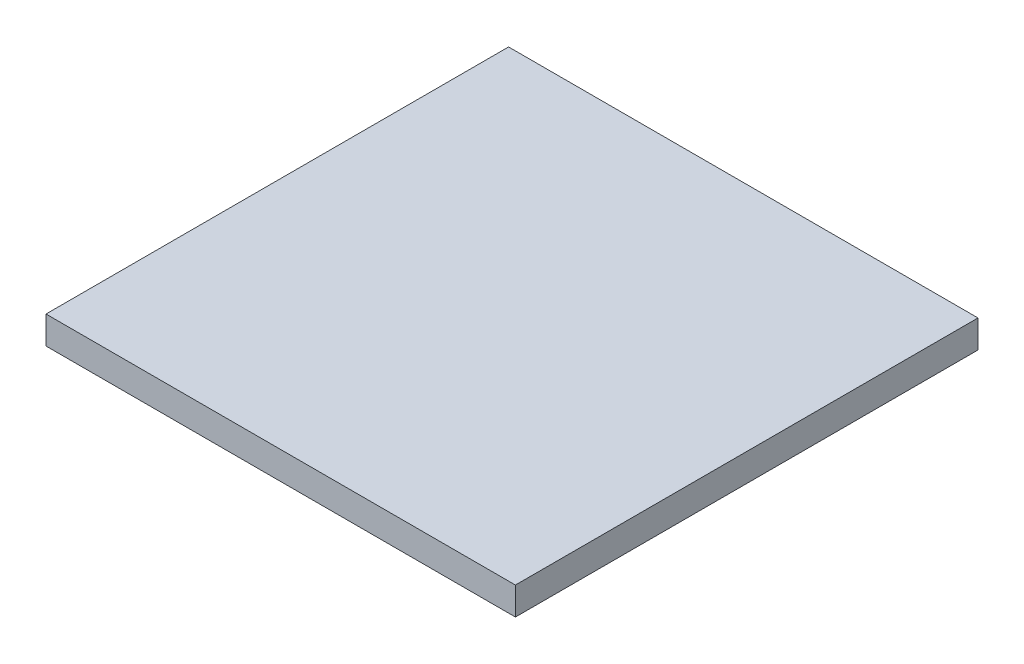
SolidWorks part; units mm, degrees
ref_plane "Front" through (0, 0, 0) normal (0, 0, 1) x (1, 0, 0)
ref_plane "Top" through (0, 0, 0) normal (0, 1, 0) x (1, 0, 0)
ref_plane "Right" through (0, 0, 0) normal (1, 0, 0) x (0, 0, -1)
sketch "Sketch1" plane through (0, 0, 0) normal (0, 1, 0) x (1, 0, 0)
  line L1 (-101.475, 100) -> (101.475, 100)
  line L2 (-101.475, 100) -> (-101.475, -100)
  line L3 (-101.475, -100) -> (101.475, -100)
  line L4 (101.475, 100) -> (101.475, -100)
  line L5 (-101.475, 100) -> (101.475, -100) construction
  line L6 (-101.475, -100) -> (101.475, 100) construction
  point P0 (0, 0)
  dimension "D1" = 200
  dimension "D2" = 202.95
extrude "Boss-Extrude1" add sketch "Sketch1" along normal blind 12
